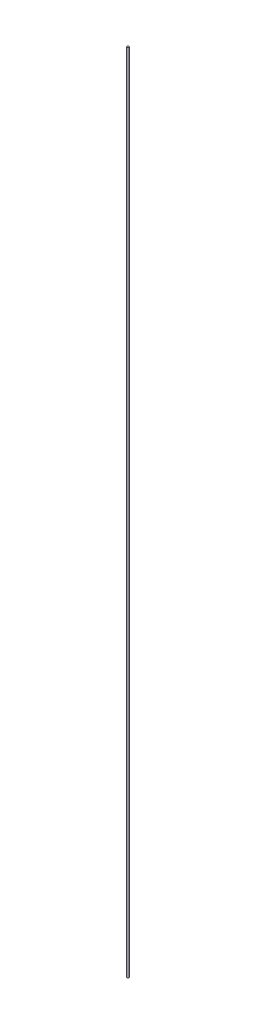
SolidWorks part; units mm, degrees
ref_plane "Plan de face" through (0, 0, 0) normal (0, 0, 1) x (1, 0, 0)
ref_plane "Plan de dessus" through (0, 0, 0) normal (0, 1, 0) x (1, 0, 0)
ref_plane "Plan de droite" through (0, 0, 0) normal (1, 0, 0) x (0, 0, -1)
sketch "Esquisse1" plane through (0, 0, 0) normal (0, 0, 1) x (1, 0, 0)
  line L0 (0, 0) -> (0, 2000)
  dimension "D1" = 2000
sketch "Esquisse2" plane through (0, 0, 0) normal (0, 1, 0) x (1, 0, 0)
  circle A0 centre (0, 0) radius 2.5
  dimension "D1" = 5
sweep "Balayage1" add profiles "Esquisse2" path "Esquisse1"
